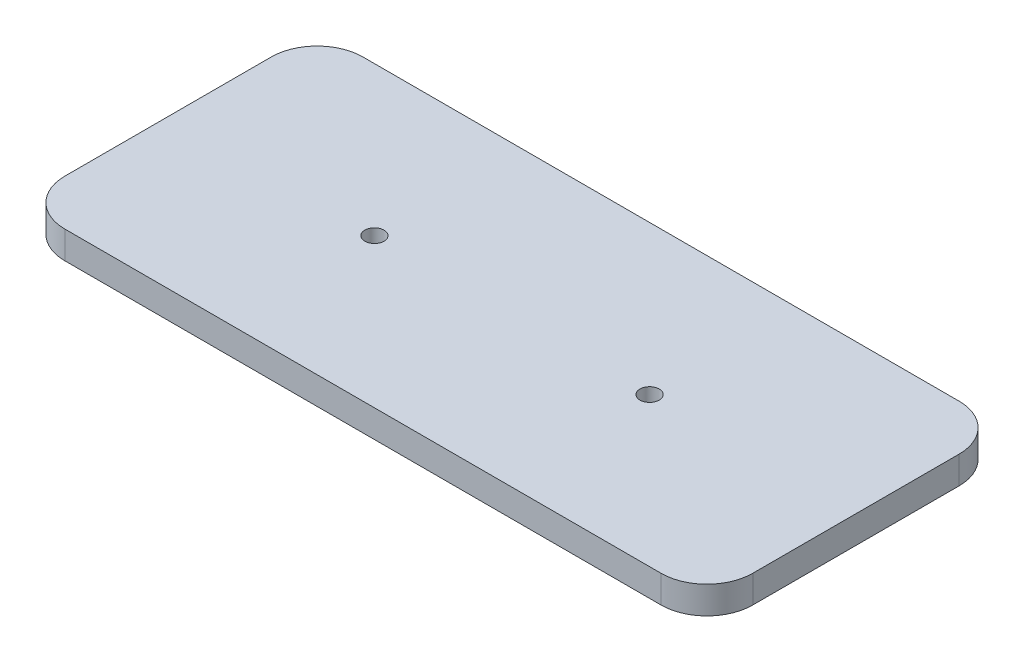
SolidWorks part; units mm, degrees
ref_plane "Front Plane" through (0, 0, 0) normal (0, 0, 1) x (1, 0, 0)
ref_plane "Top Plane" through (0, 0, 0) normal (0, 1, 0) x (1, 0, 0)
ref_plane "Right Plane" through (0, 0, 0) normal (1, 0, 0) x (0, 0, -1)
sketch "Sketch1" plane through (0, 0, 0) normal (0, 1, 0) x (1, 0, 0)
  line L1 (10, 0) -> (140, 0)
  line L2 (0, 10) -> (0, 55)
  line L3 (10, 65) -> (140, 65)
  line L4 (150, 10) -> (150, 55)
  arc A0 (150, 55) -> (140, 65) centre (140, 55) ccw
  arc A1 (140, 0) -> (150, 10) centre (140, 10) ccw
  arc A2 (0, 10) -> (10, 0) centre (10, 10) ccw
  arc A3 (10, 65) -> (0, 55) centre (10, 55) ccw
  point P7 (150, 65)
  point P12 (0, 0)
  point P15 (0, 65)
  dimension "D3" = 10
  dimension "D1" = 150
  dimension "D2" = 65
extrude "Extrude1" add sketch "Sketch1" along normal blind 6
sketch "Sketch2" plane through (0, 6, 0) normal (0, 1, 0) x (1, 0, 0)
  line L0 (0, 32.5) -> (150, 32.5) construction
  line L1 (0, 55) -> (0, 10) construction
  line L2 (150, 10) -> (150, 55) construction
  point P6 (105, 32.5)
  point P7 (45, 32.5)
  dimension "D1" = 45
  dimension "D2" = 60
hole_wizard "M5 Tapped Hole1" positions "3DSketch1" profile "Sketch3" tap size "M5" standard "ISO"
sketch3d "3DSketch1"
  point P0 (45, 6, -32.5)
  point P3 (105, 6, -32.5)
sketch "Sketch3" plane through (45, 6, -32.5) normal (1, 0, 0) x (0, 0, 1)
  line L0 (0, 0) -> (0, 6)
  line L1 (0, 6) -> (2.1, 6)
  line L2 (2.1, 6) -> (2.1, 0)
  line L5 (2.1, 0) -> (0, 0)
  line L11 (0, -6.35) -> (0, 107.95) construction
  dimension "Thru Tap Drill Dia." = 4.2
  dimension "Thru Tap Drill Depth" = 6
